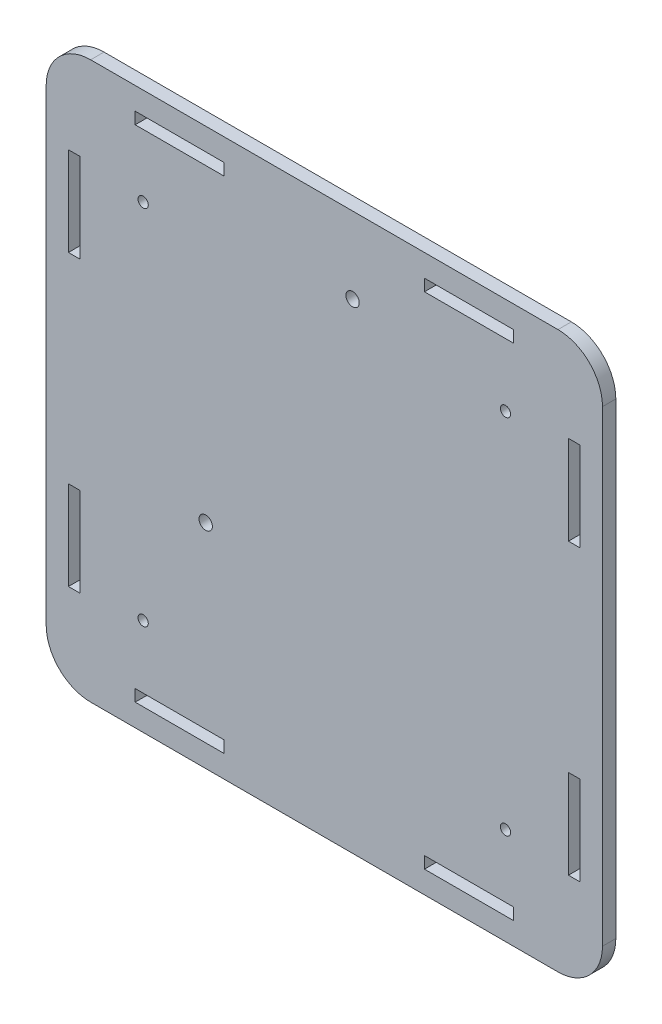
SolidWorks part; units mm, degrees
ref_plane "Alzado" through (0, 0, 0) normal (0, 0, 1) x (1, 0, 0)
ref_plane "Planta" through (0, 0, 0) normal (0, 1, 0) x (1, 0, 0)
ref_plane "Vista lateral" through (0, 0, 0) normal (1, 0, 0) x (0, 0, -1)
sketch "Croquis1" plane through (0, 0, 0) normal (0, 0, 1) x (1, 0, 0)
  line L18 (117.35, 117.35) -> (7.65, 7.65) construction
  line L19 (120, 120) -> (105, 120) construction
  line L20 (0, 0) -> (125, 0)
  line L21 (0, 0) -> (0, 125)
  line L22 (0, 125) -> (125, 125)
  line L23 (125, 0) -> (125, 125)
  line L24 (0, 0) -> (125, 125) construction
  line L25 (0, 125) -> (125, 0) construction
  line L26 (120, 40) -> (120, 85) construction
  point P0 (62.5, 62.5)
  dimension "D1" = 5
  dimension "D2" = 5
extrude "Saliente-Extruir1" add sketch "Croquis1" along normal blind 3
fillet "Redondeo1" radius 10 4 edges at (0, 125, 1.5) (125, 125, 1.5) (125, 0, 1.5) (0, 0, 1.5)
sketch "Croquis2" plane through (0, 0, 3) normal (0, 0, 1) x (1, 0, 0)
  line L0 (0, 62.5) -> (62.5, 62.5) construction
  line L1 (5, 20) -> (7.65, 20)
  line L2 (5, 20) -> (5, 40)
  line L3 (5, 40) -> (7.65, 40)
  line L4 (7.65, 20) -> (7.65, 40)
  line L5 (0, 115) -> (0, 10) construction
  line L6 (7.65, 20) -> (7.65, 3.2064) construction
  line L7 (10, 0) -> (115, 0) construction
  line L8 (62.5, 0) -> (62.5, 62.5) construction
  line L9 (7.65, 105) -> (7.65, 85)
  line L10 (5, 85) -> (7.65, 85)
  line L11 (5, 105) -> (5, 85)
  line L12 (5, 105) -> (7.65, 105)
  line L13 (120, 105) -> (117.35, 105)
  line L14 (120, 105) -> (120, 85)
  line L15 (120, 85) -> (117.35, 85)
  line L16 (117.35, 105) -> (117.35, 85)
  line L17 (117.35, 20) -> (117.35, 40)
  line L18 (120, 40) -> (117.35, 40)
  line L19 (120, 20) -> (120, 40)
  line L20 (120, 20) -> (117.35, 20)
  line L29 (20, 7.65) -> (7.65, 7.65) construction
  line L30 (85, 7.65) -> (85, 5)
  line L31 (20, 7.65) -> (40, 7.65)
  line L32 (20, 7.65) -> (20, 5)
  line L33 (20, 5) -> (40, 5)
  line L34 (40, 7.65) -> (40, 5)
  line L35 (105, 5) -> (85, 5)
  line L36 (105, 7.65) -> (105, 5)
  line L37 (105, 7.65) -> (85, 7.65)
  line L38 (105, 117.35) -> (85, 117.35)
  line L39 (105, 117.35) -> (105, 120)
  line L40 (105, 120) -> (85, 120)
  line L41 (40, 117.35) -> (40, 120)
  line L42 (20, 120) -> (40, 120)
  line L43 (20, 117.35) -> (20, 120)
  line L44 (20, 117.35) -> (40, 117.35)
  line L45 (85, 117.35) -> (85, 120)
extrude "Cortar-Extruir1" cut sketch "Croquis2" against normal up to surface (3 mm away)
sketch "Croquis3" plane through (0, 0, 3) normal (0, 0, 1) x (1, 0, 0)
  arc A0 (36.3868, 27.1015) -> (21.9876, 27.1015) centre (29.1872, 25) ccw construction
  arc A1 (36.3868, 27.1015) -> (21.9876, 27.1015) centre (29.1872, 25) ccw construction
  circle A2 centre (29.1872, 25) radius 7.5
extrude "Cortar-Extruir2" [suppressed] cut sketch "Croquis3" against normal up to next
sketch "Croquis4" plane through (0, 0, 3) normal (0, 0, 1) x (1, 0, 0)
  circle A0 centre (35.85, 47.85) radius 1.5 construction
  circle A1 centre (68.85, 107.85) radius 1.5 construction
  circle A10 centre (35.85, 47.85) radius 1.5
  circle A11 centre (68.85, 107.85) radius 1.5
extrude "Cortar-Extruir3" cut sketch "Croquis4" against normal up to next
ref_plane "Plano1" through (112, 50, -20) normal (-1, 0, 0) x (0, 0, 1)
sketch "Croquis6" plane through (0, 0, 3) normal (0, 0, 1) x (1, 0, 0)
  line L0 (36.3868, 27.1015) -> (41.4156, 27) construction
  line L1 (41.4156, 27) -> (41.4156, 23) construction
  line L2 (41.4156, 23) -> (36.3868, 22.8985) construction
  line L3 (16.9588, 27) -> (21.9876, 27.1015) construction
  line L4 (16.9588, 23) -> (16.9588, 27) construction
  line L5 (21.9876, 22.8985) -> (16.9588, 23) construction
  line L6 (36.3868, 27.1015) -> (41.4156, 27)
  line L7 (41.4156, 27) -> (41.4156, 23)
  line L8 (41.4156, 23) -> (36.3868, 22.8985)
  line L9 (16.9588, 27) -> (21.9876, 27.1015)
  line L10 (16.9588, 23) -> (16.9588, 27)
  line L11 (21.9876, 22.8985) -> (16.9588, 23)
  arc A0 (21.9876, 22.8985) -> (36.3868, 22.8985) centre (29.1872, 25) ccw construction
  arc A1 (36.3868, 27.1015) -> (21.9876, 27.1015) centre (29.1872, 25) ccw construction
  arc A2 (21.9876, 22.8985) -> (36.3868, 22.8985) centre (29.1872, 25) ccw
  arc A3 (36.3868, 27.1015) -> (21.9876, 27.1015) centre (29.1872, 25) ccw
extrude "Cortar-Extruir4" [suppressed] cut sketch "Croquis6" against normal up to next
sketch "Croquis7" plane through (0, 0, 3) normal (0, 0, 1) x (1, 0, 0)
  line L0 (14.7211, 110.2789) -> (110.2789, 14.7211) construction
  line L1 (110.2789, 110.2789) -> (14.7211, 14.7211) construction
  circle A0 centre (110.2789, 110.2789) radius 1.15 construction
  circle A1 centre (110.2789, 14.7211) radius 1.15 construction
  circle A2 centre (14.7211, 14.7211) radius 1.15 construction
  circle A3 centre (14.7211, 110.2789) radius 1.15 construction
  circle A4 centre (110.2789, 110.2789) radius 1.15 construction
  circle A5 centre (110.2789, 14.7211) radius 1.15 construction
  circle A6 centre (14.7211, 14.7211) radius 1.15 construction
  circle A7 centre (14.7211, 110.2789) radius 1.15 construction
  circle A8 centre (21.7921, 103.2079) radius 1.15
  circle A9 centre (103.2079, 103.2079) radius 1.15
  circle A10 centre (103.2079, 21.7921) radius 1.15
  circle A11 centre (21.7921, 21.7921) radius 1.15
  dimension "D1" = 10
  dimension "D2" = 10
  dimension "D3" = 10
  dimension "D4" = 10
extrude "Cortar-Extruir5" cut sketch "Croquis7" against normal up to next
